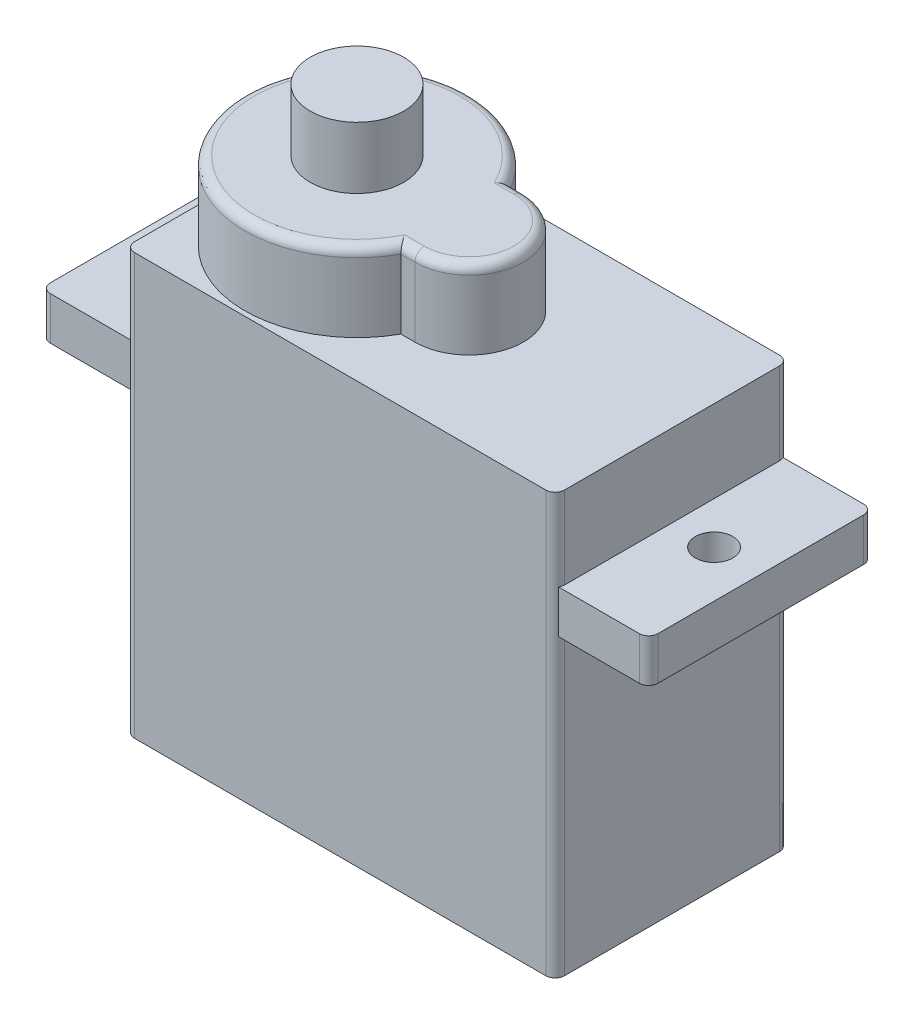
SolidWorks part; units mm, degrees
ref_plane "Přední rovina" through (0, 0, 0) normal (0, 0, 1) x (1, 0, 0)
ref_plane "Horní rovina" through (0, 0, 0) normal (0, 1, 0) x (1, 0, 0)
ref_plane "Pravá rovina" through (0, 0, 0) normal (1, 0, 0) x (0, 0, -1)
sketch "Skica1" plane through (0, 0, 0) normal (0, 1, 0) x (1, 0, 0)
  line L1 (-6.15, 6.25) -> (16.85, 6.25)
  line L2 (-6.15, 6.25) -> (-6.15, -6.25)
  line L3 (-6.15, -6.25) -> (16.85, -6.25)
  line L4 (16.85, 6.25) -> (16.85, -6.25)
  point P4 (-6.15, 0)
  dimension "D1" = 6.15
  dimension "D2" = 12.5
  dimension "D3" = 23
extrude "Vysunout1" add sketch "Skica1" against normal blind 22.5
sketch "Skica2" plane through (0, 0, 0) normal (0, 1, 0) x (-1, 0, 0)
  line L0 (0, 0) -> (-12, 0) construction
  line L2 (-6, 2.9) -> (-5.2526, 2.9)
  line L3 (-6, -2.9) -> (-5.2526, -2.9)
  circle A1 centre (0, 0) radius 5.8 construction
  circle A2 centre (-6, 0) radius 2.7 construction
  arc A3 (-6, 2.9) -> (-6, -2.9) centre (-6, 0) ccw
  arc A4 (-5.2526, -2.9) -> (-5.2526, 2.9) centre (0, 0) ccw
  dimension "D1" = 12
  dimension "D2" = 14.5
  dimension "D3" = 11.6
  dimension "D4" = 5.4
  dimension "D5" = 5.8
extrude "Vysunout2" add sketch "Skica2" along normal blind 4.2
sketch "Skica3" plane through (0, 4.2, 0) normal (0, 1, 0) x (-1, 0, 0)
  circle A0 centre (0, 0) radius 2.5
  dimension "D2" = 5
extrude "Vysunout3" add sketch "Skica3" along normal offset from surface (3.3 mm away) 30
ref_plane "Rovina1" through (0, -6.7, 0) normal (0, 1, 0) x (-1, 0, 0)
sketch "Skica4" plane through (0, -6.7, 0) normal (0, 1, 0) x (-1, 0, 0)
  line L0 (0, 7.8405) -> (0, -8.097) construction
  line L1 (-21.6, 6) -> (10.9, 6)
  line L2 (-21.6, 6) -> (-21.6, -6)
  line L3 (-21.6, -6) -> (10.9, -6)
  line L4 (10.9, 6) -> (10.9, -6)
  line L7 (-12.1456, 0) -> (23.9604, 0) construction
  line L8 (-5.35, 6) -> (-5.35, -8.985) construction
  line L9 (-16.85, 6.25) -> (-16.85, -6.25) construction
  line L10 (6.15, -6.25) -> (6.15, 6.25) construction
  circle A0 centre (-19.1, 0) radius 1
  circle A1 centre (8.4, 0) radius 1
  point P4 (-21.6, 0)
  dimension "D5" = 2
  dimension "D6" = 27.5
  dimension "D1" = 32.5
  dimension "D2" = 12
extrude "Vysunout4" add sketch "Skica4" along normal blind 2.3
fillet "Zaoblit1" radius 0.5 4 edges at (21.6, -5.55, 6) (21.6, -5.55, -6) (-10.9, -5.55, 6) (-10.9, -5.55, -6)
fillet "Zaoblit2" radius 0.5 8 edges at (16.85, -11.25, 6.25) (-6.15, -11.25, 6.25) (-6.15, -11.25, -6.25) (16.85, -11.25, -6.25) (5.6263, 4.2, 2.9) (5.6263, 4.2, -2.9) (8.9, 4.2, 0) (-6, 4.2, 0)
